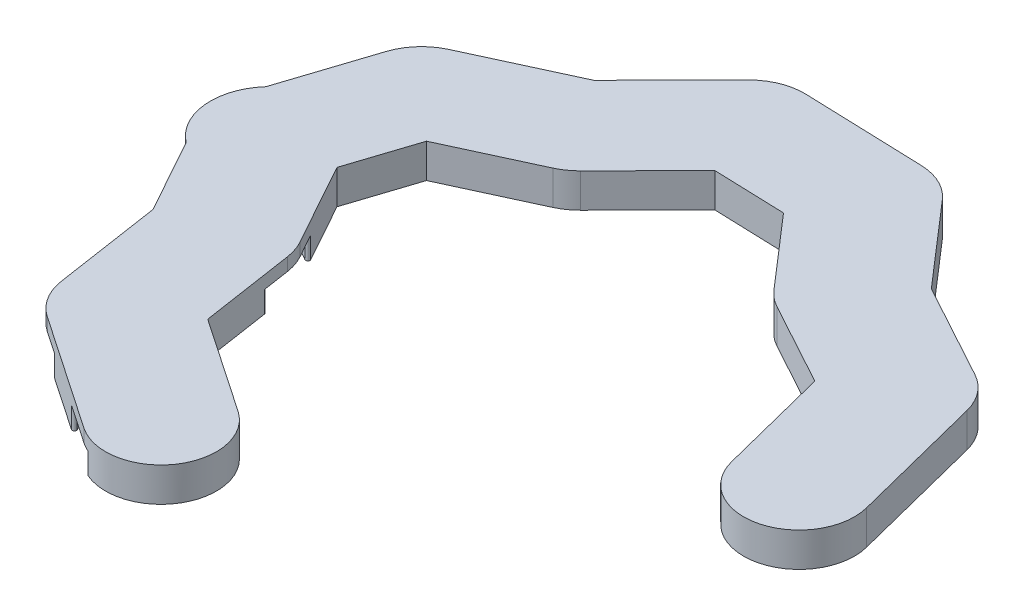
SolidWorks part; units mm, degrees
ref_plane "Front Plane" through (0, 0, 0) normal (0, 0, 1) x (1, 0, 0)
ref_plane "Top Plane" through (0, 0, 0) normal (0, 1, 0) x (1, 0, 0)
ref_plane "Right Plane" through (0, 0, 0) normal (1, 0, 0) x (0, 0, -1)
sketch "Sketch1" plane through (0, 0, 0) normal (0, 1, 0) x (1, 0, 0)
  line L0 (-26.5704, -81.0042) -> (-60.7942, -57.7049) construction
  line L1 (-60.7942, -57.7049) -> (-66.1117, -22.5447) construction
  line L2 (-66.1117, -22.5447) -> (-83.3839, 8.5388) construction
  line L3 (-83.3839, 8.5388) -> (-72.3401, 42.3403) construction
  line L4 (-72.3401, 42.3403) -> (-40.0473, 57.2297) construction
  line L5 (-40.0473, 57.2297) -> (-14.9962, 82.4676) construction
  line L6 (-14.9962, 82.4676) -> (20.5434, 81.2635) construction
  line L7 (20.5434, 81.2635) -> (43.8289, 54.3879) construction
  line L8 (43.8289, 54.3879) -> (75.0399, 37.3471) construction
  line L9 (75.0399, 37.3471) -> (86.1071, -6.3492) construction
  line L10 (-17.2793, -67.3566) -> (-45.5473, -48.1121)
  line L11 (-70.0853, -71.3524) -> (-35.8615, -94.6517)
  line L12 (-49.7873, -20.0759) -> (-45.5473, -48.1121)
  line L13 (-81.9905, -27.9596) -> (-77.1186, -60.1737)
  line L14 (-65.4527, 10.26) -> (-51.6801, -14.5255)
  line L15 (-94.3159, -5.7785) -> (-81.9905, -27.9596)
  line L16 (-58.8842, 30.3641) -> (-65.4527, 10.26)
  line L17 (-33.1344, 42.2366) -> (-58.8842, 30.3641)
  line L18 (-26.7138, 94.0985) -> (-49.666, 70.9752)
  line L19 (12.7835, 65.007) -> (-8.3543, 65.7231)
  line L20 (12.7835, 65.007) -> (31.351, 43.5768)
  line L21 (35.9171, 39.8971) -> (60.8042, 26.309)
  line L22 (60.8042, 26.309) -> (69.2004, -6.8412)
  line L23 (-96.8399, 20.515) -> (-88.0337, 47.4678)
  line L24 (-79.253, 57.3334) -> (-49.666, 70.9752)
  line L25 (-28.3297, 45.5988) -> (-8.3543, 65.7231)
  line L26 (-14.4372, 98.9681) -> (21.1024, 97.7641)
  line L27 (33.0214, 92.0747) -> (54.3558, 67.4509)
  line L28 (54.3558, 67.4509) -> (82.9517, 51.8379)
  line L29 (91.0445, 41.4007) -> (101.2096, 1.2659)
  arc A0 (-35.8615, -94.6517) -> (-17.2793, -67.3566) centre (-26.5704, -81.0042) ccw
  arc A2 (69.2004, -6.8412) -> (101.2096, 1.2659) centre (85.205, -2.7876) ccw
  arc A3 (-49.7873, -20.0759) -> (-51.6801, -14.5255) centre (-66.1117, -22.5447) ccw
  arc A6 (-33.1344, 42.2366) -> (-28.3297, 45.5988) centre (-40.0473, 57.2297) ccw
  arc A9 (31.351, 43.5768) -> (35.9171, 39.8971) centre (43.8289, 54.3879) ccw
  circle A10 centre (83.7707, 2.8756) radius 17.272 construction
  circle A11 centre (-31.3995, -77.7166) radius 17.272 construction
  circle A14 centre (43.8289, 54.3879) radius 17.272 construction
  circle A17 centre (-40.0473, 57.2297) radius 17.272 construction
  circle A20 centre (-66.1117, -22.5447) radius 17.272 construction
  arc A22 (-77.1186, -60.1737) -> (-70.0853, -71.3524) centre (-60.7942, -57.7049) ccw
  arc A24 (-96.8399, 20.515) -> (-94.3159, -5.7785) centre (-83.3839, 8.5388) ccw
  arc A25 (-79.253, 57.3334) -> (-88.0337, 47.4678) centre (-72.3401, 42.3403) ccw
  arc A27 (-14.4372, 98.9681) -> (-26.7138, 94.0985) centre (-14.9962, 82.4676) ccw
  arc A28 (33.0214, 92.0747) -> (21.1024, 97.7641) centre (20.5434, 81.2635) ccw
  arc A30 (91.0445, 41.4007) -> (82.9517, 51.8379) centre (75.0399, 37.3471) ccw
  dimension "D1" = 5.08
  dimension "D2" = 5.08
extrude "Boss-Extrude1" add sketch "Sketch1" along normal blind 10.16
sketch "Sketch5" plane through (0, 0, 0) normal (0, -1, 0) x (1, 0, 0)
  line L2 (-22.9969, 75.7551) -> (-51.2649, 56.5105)
  line L3 (-41.1035, 63.4283) -> (-43.9432, 61.4951)
  line L5 (-55.593, 49.6313) -> (-59.8331, 21.5952)
  line L6 (-56.9175, 40.8736) -> (-57.4312, 37.4769)
  line L8 (-71.9448, 26.4403) -> (-67.0728, 58.6545)
  line L9 (-69.9884, 39.376) -> (-69.4747, 42.7727)
  line L11 (-64.3677, 62.954) -> (-30.1439, 86.2532)
  line L12 (-51.0902, 71.9932) -> (-48.2505, 73.9264)
  arc A0 (-41.1035, 63.4283) -> (-48.2505, 73.9264) centre (-31.3995, 77.7166) ccw
  arc A1 (-56.9175, 40.8736) -> (-43.9432, 61.4951) centre (-60.7942, 57.7049) ccw
  arc A2 (-69.9884, 39.376) -> (-57.4312, 37.4769) centre (-66.1117, 22.5447) ccw
  circle A3 centre (-31.3995, 77.7166) radius 17.272 construction
  arc A4 (-51.0902, 71.9932) -> (-69.4747, 42.7727) centre (-60.7942, 57.7049) ccw
  dimension "D1" = 10.16
  dimension "D2" = 10.16
  dimension "D3" = 10.16
  dimension "D4" = 10.16
extrude "Cut-Extrude1" cut sketch "Sketch5" against normal blind 6.35
fillet "Fillet1" radius 0.635 18 edges at (-36.4967, 3.175, 94.2193) (-44.8846, 3.175, 88.5089) (-65.8913, 3.175, 74.2077) (-77.8773, 3.175, 55.1571) (-69.9884, 3.175, 39.376) (-69.4747, 3.175, 42.7727) (-51.0902, 3.175, 71.9932) (-48.2505, 3.175, 73.9264) (-41.1035, 3.175, 63.4283) (-26.3024, 3.175, 61.2138) (-17.9144, 3.175, 66.9242) (-57.4312, 3.175, 37.4769) (-56.9175, 3.175, 40.8736) (-43.9432, 3.175, 61.4951) (-54.1445, 3.175, 10.0905) (-49.0286, 3.175, 25.0925) (-83.0077, 3.175, 26.129) (-81.6774, 3.175, 30.0302)
